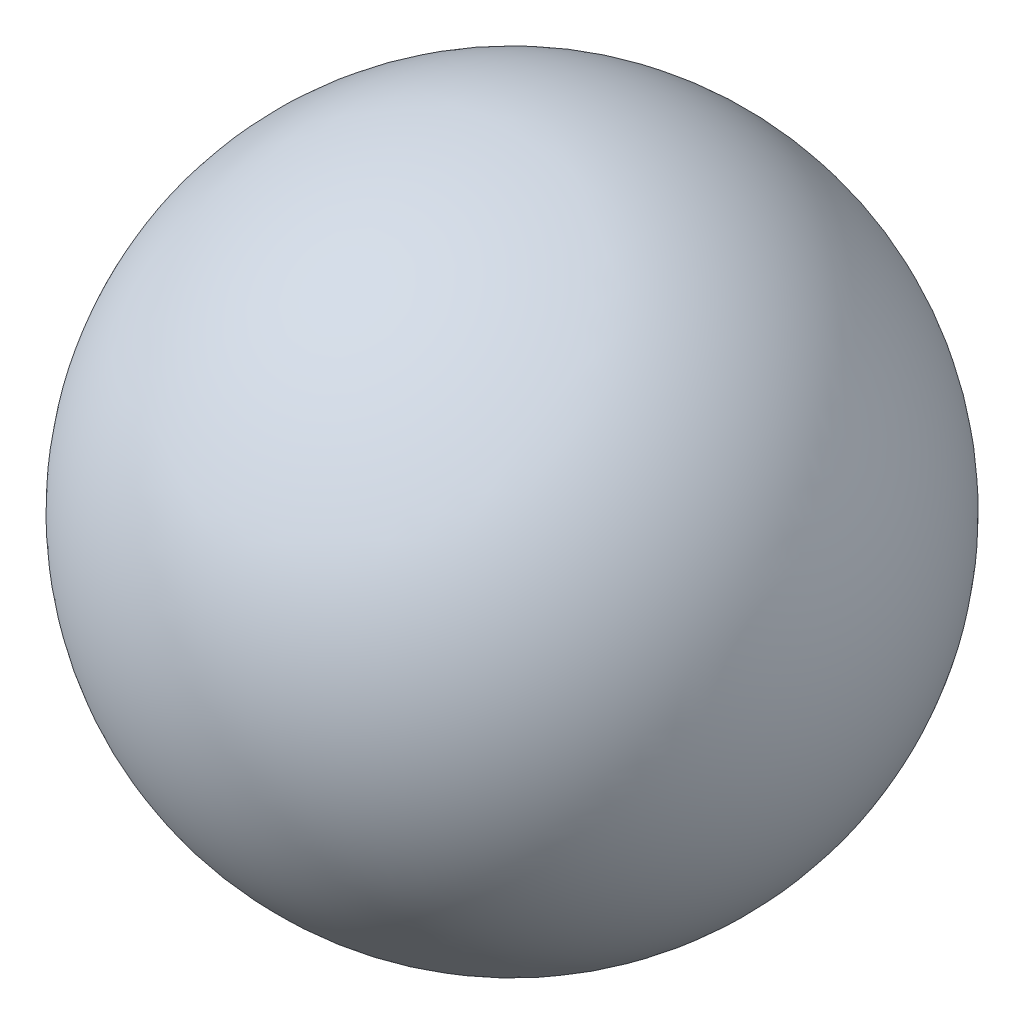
SolidWorks part; units mm, degrees
ref_plane "Plan de face" through (0, 0, 0) normal (0, 0, 1) x (1, 0, 0)
ref_plane "Plan de dessus" through (0, 0, 0) normal (0, 1, 0) x (1, 0, 0)
ref_plane "Plan de droite" through (0, 0, 0) normal (1, 0, 0) x (0, 0, -1)
sketch "Esquisse1" plane through (0, 0, 0) normal (0, 0, 1) x (1, 0, 0)
  line L0 (1.3, 10.5) -> (6.7, 10.5)
  line L1 (1.3, 10.5) -> (6.7, 10.5) construction
  arc A0 (6.7, 10.5) -> (1.3, 10.5) centre (4, 10.5) cw
revolve "Révolution1" add sketch "Esquisse1" angle 360 about L1
